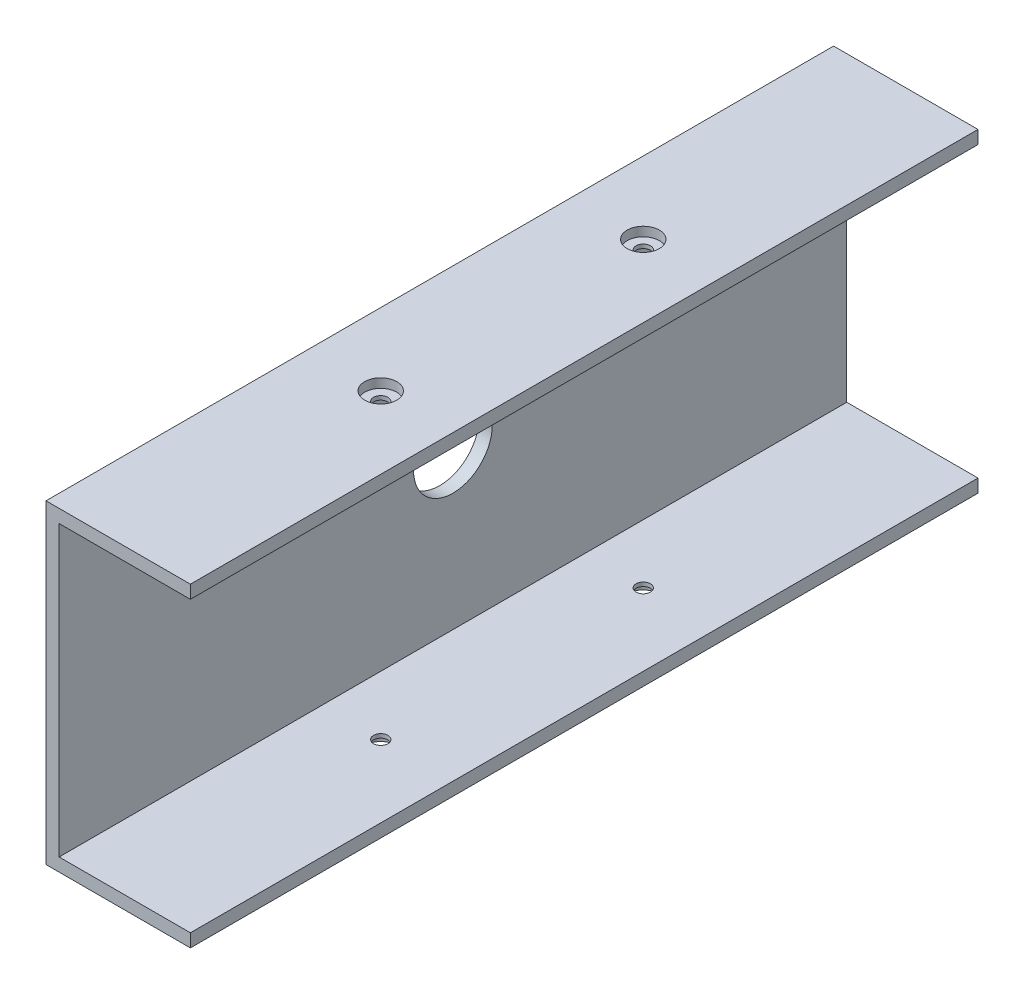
SolidWorks part; units mm, degrees
ref_plane "Front Plane" through (0, 0, 0) normal (0, 0, 1) x (1, 0, 0)
ref_plane "Top Plane" through (0, 0, 0) normal (0, 1, 0) x (1, 0, 0)
ref_plane "Right Plane" through (0, 0, 0) normal (1, 0, 0) x (0, 0, -1)
sketch "Sketch1" plane through (0, 0, 0) normal (0, 0, 1) x (1, 0, 0)
  line L0 (-64.6685, 67.8221) -> (-9.6685, 67.8221)
  line L1 (-9.6685, 67.8221) -> (-9.6685, 62.8221)
  line L2 (-9.6685, 62.8221) -> (-59.6685, 62.8221)
  line L3 (-59.6685, 62.8221) -> (-59.6685, -47.1779)
  line L4 (-59.6685, -47.1779) -> (-9.6685, -47.1779)
  line L5 (-9.6685, -47.1779) -> (-9.6685, -52.1779)
  line L6 (-9.6685, -52.1779) -> (-64.6685, -52.1779)
  line L7 (-64.6685, -52.1779) -> (-64.6685, 67.8221)
  point P6 (-64.6685, 7.8221)
  point P10 (-59.6685, 7.8221)
  dimension "D1" = 110
  dimension "D2" = 5
  dimension "D3" = 5
  dimension "D4" = 50
  dimension "D5" = 50
extrude "Boss-Extrude1" add sketch "Sketch1" along normal blind 300
sketch "Sketch2" plane through (0, 67.8221, 0) normal (0, 1, 0) x (1, 0, 0)
  line L0 (-64.6685, -300) -> (-64.6685, 0) construction
  line L1 (-9.6685, -300) -> (-9.6685, 0) construction
  line L2 (-9.6685, -300) -> (-64.6685, -300) construction
  point P0 (-37.1685, -200)
  point P1 (-32.1685, -200)
  dimension "D1" = 27.5
  dimension "D2" = 22.5
  dimension "D3" = 100
  dimension "D4" = 100
hole_wizard "CBORE for M5 Hex Head Bolt1" positions "Sketch3" profile "Sketch4" counterbore size "M5" standard "ISO"
sketch "Sketch3" plane through (0, 67.8221, 0) normal (0, 1, 0) x (1, 0, 0)
  point P0 (-37.1685, -200)
sketch "Sketch4" plane through (-37.1685, 67.8221, 200) normal (1, 0, 0) x (0, 0, 1)
  line L0 (0, 0) -> (0, 11.7024)
  line L1 (0, 11.7024) -> (2.75, 10.05)
  line L2 (2.75, 10.05) -> (2.75, 3.5)
  line L3 (2.75, 3.5) -> (6.119, 3.5)
  line L4 (6.119, 3.5) -> (6.119, 0)
  line L5 (6.119, 0) -> (0, 0)
  line L10 (0, 11.7024) -> (-2.75, 10.05) construction
  line L11 (0, -6.35) -> (0, 107.95) construction
  dimension "Hole Dia." = 5.5
  dimension "Hole Depth" = 10.05
  dimension "C'Bore Dia." = 12.238
  dimension "C'Bore Depth" = 3.5
  dimension "Drill Angle" = 118
pattern_linear "LPattern2" count 2 spacing 100 along (0, 0, -1) of "CBORE for M5 Hex Head Bolt1"
hole_wizard "CBORE for M5 Hex Head Bolt3" positions "Sketch7" profile "Sketch8" counterbore size "M5" standard "ISO"
sketch "Sketch7" plane through (0, -52.1779, 0) normal (0, -1, 0) x (-1, 0, 0)
  point P0 (37.1685, -200)
sketch "Sketch8" plane through (-37.1685, -52.1779, 200) normal (1, 0, 0) x (0, 0, -1)
  line L0 (0, 0) -> (0, 11.7024)
  line L1 (0, 11.7024) -> (2.75, 10.05)
  line L2 (2.75, 10.05) -> (2.75, 3.5)
  line L3 (2.75, 3.5) -> (6.119, 3.5)
  line L4 (6.119, 3.5) -> (6.119, 0)
  line L5 (6.119, 0) -> (0, 0)
  line L10 (0, 11.7024) -> (-2.75, 10.05) construction
  line L11 (0, -6.35) -> (0, 107.95) construction
  dimension "Hole Dia." = 5.5
  dimension "Hole Depth" = 10.05
  dimension "C'Bore Dia." = 12.238
  dimension "C'Bore Depth" = 3.5
  dimension "Drill Angle" = 118
pattern_linear "LPattern3" count 2 spacing 100 along (0, 0, -1) of "CBORE for M5 Hex Head Bolt3"
sketch "Sketch9" plane through (-64.6685, 0, 0) normal (-1, 0, 0) x (0, 0, 1)
  line L0 (300, 67.8221) -> (300, -52.1779) construction
  line L1 (300, 67.8221) -> (0, 67.8221) construction
  circle A0 centre (150, 12.8221) radius 15
  point P0 (150, 12.8221)
  dimension "D3" = 30
  dimension "D1" = 150
  dimension "D2" = 55
extrude "Cut-Extrude1" cut sketch "Sketch9" against normal through all
